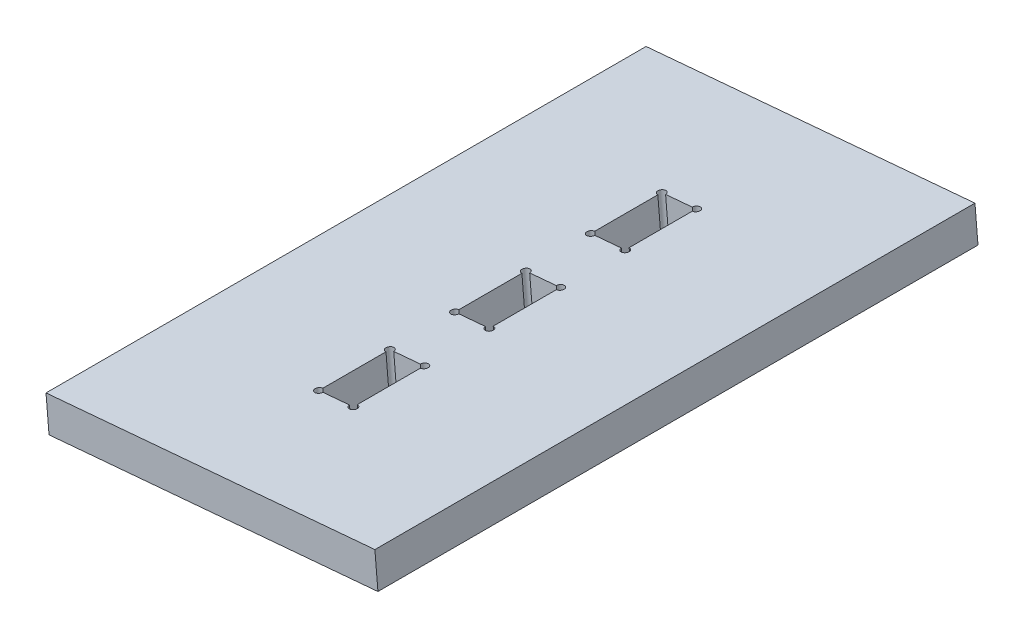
SolidWorks part; units mm, degrees
ref_plane "Front Plane" through (0, 0, 0) normal (0, 0, 1) x (1, 0, 0)
ref_plane "Top Plane" through (0, 0, 0) normal (0, 1, 0) x (1, 0, 0)
ref_plane "Right Plane" through (0, 0, 0) normal (1, 0, 0) x (0, 0, -1)
sketch "Sketch1" plane through (-0.3717, 4.2485, 0) normal (-0.0872, 0.9962, 0) x (0.9962, 0.0872, 0)
  line L1 (62.447, -58.9816) -> (232.447, -58.9816)
  line L2 (232.447, -58.9816) -> (232.447, 250.0184)
  line L3 (232.447, 250.0184) -> (62.447, 250.0184)
  line L5 (62.447, -58.9816) -> (62.447, 250.0184)
  dimension "D1" = 309
  dimension "D2" = 170
extrude "Boss-Extrude1" add sketch "Sketch1" along normal blind 18
sketch "Sketch2" plane through (-1.9405, 22.18, 0) normal (-0.0872, 0.9962, 0) x (0.9962, 0.0872, 0)
  line L0 (156.347, 5.7684) -> (138.547, 5.7684)
  line L1 (138.547, 42.2684) -> (138.547, 5.7684)
  line L2 (138.547, 42.2684) -> (156.347, 42.2684)
  line L3 (156.347, 42.2684) -> (156.347, 5.7684)
  line L4 (62.447, -58.9816) -> (232.447, -58.9816) construction
  line L6 (147.447, 250.0184) -> (147.447, -86.7375) construction
  line L7 (232.447, 250.0184) -> (62.447, 250.0184) construction
  point P2 (156.347, 24.0184)
  point P6 (147.447, 5.7684)
  point P12 (147.447, 42.2684)
  dimension "D1" = 36.5
  dimension "D2" = 83
  dimension "D3" = 17.8
extrude "Cut-Extrude1" cut sketch "Sketch2" against normal up to next
pattern_linear "LPattern1" count 3 spacing 70 along (0, 0, -1) of "Cut-Extrude1"
sketch "Sketch3" plane through (-1.9405, 22.18, 0) normal (-0.0872, 0.9962, 0) x (0.9962, 0.0872, 0)
  circle A0 centre (156.347, 182.2684) radius 2
  circle A1 centre (138.547, 182.2684) radius 2
  circle A2 centre (138.547, 145.7684) radius 2
  circle A3 centre (156.347, 145.7684) radius 2
  circle A4 centre (156.347, 112.2684) radius 2
  circle A5 centre (138.547, 112.2684) radius 2
  circle A6 centre (138.547, 75.7684) radius 2
  circle A7 centre (156.347, 75.7684) radius 2
  circle A8 centre (156.347, 42.2684) radius 2
  circle A9 centre (138.547, 42.2684) radius 2
  circle A10 centre (138.547, 5.7684) radius 2
  circle A11 centre (156.347, 5.7684) radius 2
  dimension "D1" = 4
extrude "Cut-Extrude2" cut sketch "Sketch3" against normal up to next
